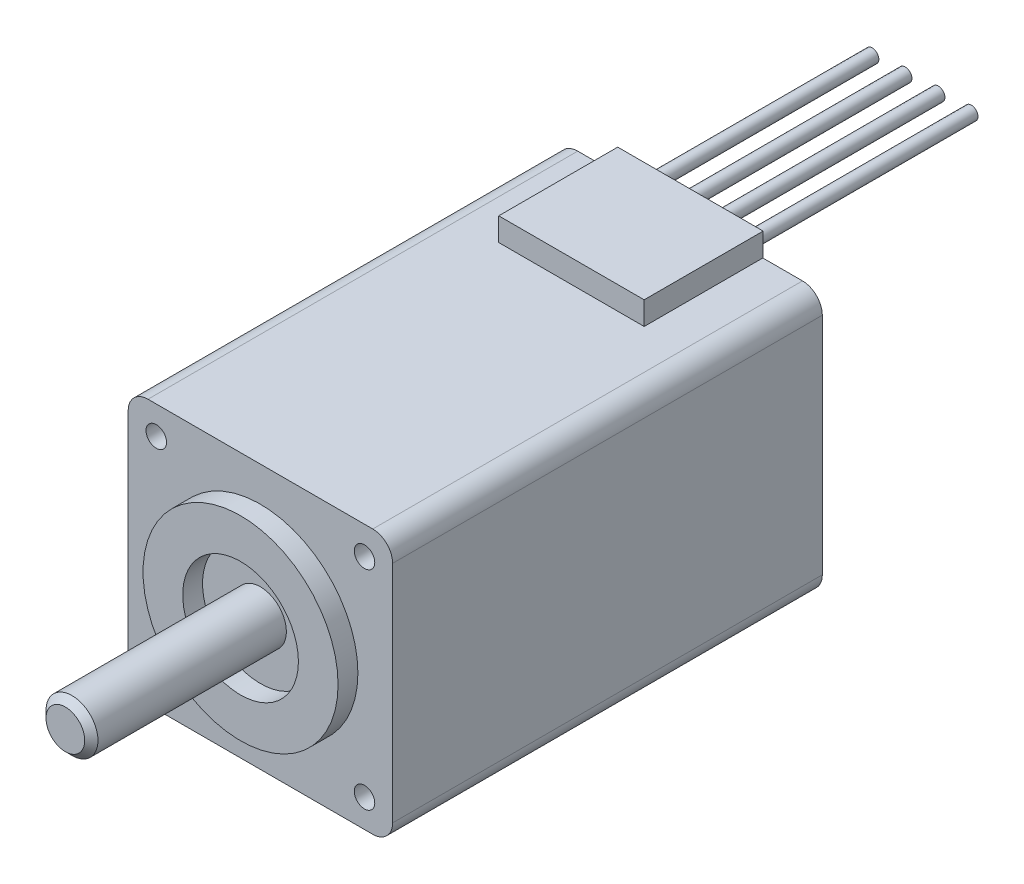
SolidWorks part; units mm, degrees
ref_plane "Front Plane" through (0, 0, 0) normal (0, 0, 1) x (1, 0, 0)
ref_plane "Top Plane" through (0, 0, 0) normal (0, 1, 0) x (1, 0, 0)
ref_plane "Right Plane" through (0, 0, 0) normal (1, 0, 0) x (0, 0, -1)
ref_plane "Plane1" through (0, -10.16, 0) normal (0, -1, 0) x (1, 0, 0)
sketch "Sketch1" plane through (0, -10.16, 0) normal (0, -1, 0) x (1, 0, 0)
  line L0 (10.16, 33.02) -> (-10.16, 33.02)
  line L1 (-10.16, 33.02) -> (-10.16, 0)
  line L2 (-10.16, 0) -> (10.16, 0)
  line L3 (10.16, 0) -> (10.16, 33.02)
extrude "Boss-Extrude1" add sketch "Sketch1" against normal blind 20.32
sketch "Sketch2" plane through (0, 0, 0) normal (0, 0, -1) x (-1, 0, 0)
  line L0 (-5.588, 10.16) -> (5.588, 10.16)
  line L1 (5.588, 10.16) -> (5.588, 8.128)
  line L2 (5.588, 8.128) -> (-5.588, 8.128)
  line L3 (-5.588, 8.128) -> (-5.588, 10.16)
extrude "Boss-Extrude2" add sketch "Sketch2" along normal blind 0.0254
sketch "Sketch3" plane through (0, 10.16, 0) normal (0, 1, 0) x (-1, 0, 0)
  line L0 (-5.588, 9.1186) -> (5.588, 9.1186)
  line L1 (5.588, 9.1186) -> (5.588, -0.0254)
  line L2 (5.588, -0.0254) -> (-5.588, -0.0254)
  line L3 (-5.588, -0.0254) -> (-5.588, 9.1186)
extrude "Boss-Extrude3" add sketch "Sketch3" along normal blind 1.778
sketch "Sketch4" plane through (0, 0, 33.02) normal (0, 0, 1) x (1, 0, 0)
  circle A0 centre (0, 0) radius 7.493
extrude "Boss-Extrude4" add sketch "Sketch4" along normal blind 1.524
hole_wizard "M8 Clearance Hole1" positions "Sketch6" profile "Sketch5" hole size "M8" standard "ANSI Metric"
sketch "Sketch6" plane through (0, 0, 34.544) normal (0, 0, 1) x (1, 0, 0)
  point P0 (0, 0)
sketch "Sketch5" plane through (0, 0, 34.544) normal (1, 0, 0) x (0, -1, 0)
  line L0 (0, 0) -> (0, 1.524)
  line L1 (0, 1.524) -> (4.445, 1.524)
  line L2 (4.445, 1.524) -> (4.445, 0)
  line L5 (4.445, 0) -> (0, 0)
  line L10 (0, 1.524) -> (-4.445, 1.524) construction
  line L11 (0, -6.35) -> (0, 107.95) construction
  dimension "Hole Dia." = 8.89
  dimension "Hole Depth" = 1.524
  dimension "Drill Angle" = 180
ref_plane "Plane2" through (0, 10.033, 0) normal (0, -1, 0) x (1, 0, 0)
sketch "Sketch7" plane through (0, 10.033, 0) normal (0, -1, 0) x (1, 0, 0)
  line L0 (-3.302, -0.0254) -> (-3.81, -0.0254)
  line L1 (-3.81, -0.0254) -> (-3.81, -17.8054)
  line L2 (-3.81, -17.8054) -> (-3.302, -17.8054)
  line L3 (-3.302, -17.8054) -> (-3.302, -0.0254)
  line L4 (-3.81, -0.0254) -> (-3.81, -17.8054) construction
revolve "Revolve1" add sketch "Sketch7" angle 360 about L4
sketch "Sketch8" plane through (0, 10.033, 0) normal (0, -1, 0) x (1, 0, 0)
  line L0 (1.778, -0.0254) -> (1.27, -0.0254)
  line L1 (1.27, -0.0254) -> (1.27, -17.8054)
  line L2 (1.27, -17.8054) -> (1.778, -17.8054)
  line L3 (1.778, -17.8054) -> (1.778, -0.0254)
  line L4 (1.27, -0.0254) -> (1.27, -17.8054) construction
revolve "Revolve2" add sketch "Sketch8" angle 360 about L4
sketch "Sketch9" plane through (0, 10.033, 0) normal (0, -1, 0) x (1, 0, 0)
  line L0 (4.318, -0.0254) -> (3.81, -0.0254)
  line L1 (3.81, -0.0254) -> (3.81, -17.8054)
  line L2 (3.81, -17.8054) -> (4.318, -17.8054)
  line L3 (4.318, -17.8054) -> (4.318, -0.0254)
  line L4 (3.81, -0.0254) -> (3.81, -17.8054) construction
revolve "Revolve3" add sketch "Sketch9" angle 360 about L4
sketch "Sketch10" plane through (0, 10.033, 0) normal (0, -1, 0) x (1, 0, 0)
  line L0 (-0.762, -0.0254) -> (-1.27, -0.0254)
  line L1 (-1.27, -0.0254) -> (-1.27, -17.8054)
  line L2 (-1.27, -17.8054) -> (-0.762, -17.8054)
  line L3 (-0.762, -17.8054) -> (-0.762, -0.0254)
  line L4 (-1.27, -0.0254) -> (-1.27, -17.8054) construction
revolve "Revolve4" add sketch "Sketch10" angle 360 about L4
sketch "Sketch11" plane through (0, 0, 0) normal (0, 1, 0) x (1, 0, 0)
  line L0 (1.9964, -33.02) -> (0, -33.02)
  line L1 (0, -33.02) -> (0, -48.006)
  line L2 (0, -48.006) -> (1.9964, -48.006)
  line L3 (1.9964, -48.006) -> (1.9964, -33.02)
  line L4 (0, -33.02) -> (0, -48.006) construction
revolve "Revolve5" add sketch "Sketch11" angle 360 about L4
hole_wizard "M8 Clearance Hole2" positions "Sketch13" profile "Sketch12" hole size "M8" standard "ANSI Metric"
sketch "Sketch13" plane through (0, 0, 0) normal (0, 0, -1) x (-1, 0, 0)
  point P0 (0, 0)
sketch "Sketch12" plane through (0, 0, 0) normal (1, 0, 0) x (0, 1, 0)
  line L0 (0, 0) -> (0, 0.254)
  line L1 (0, 0.254) -> (4.445, 0.254)
  line L2 (4.445, 0.254) -> (4.445, 0)
  line L5 (4.445, 0) -> (0, 0)
  line L10 (0, 0.254) -> (-4.445, 0.254) construction
  line L11 (0, -6.35) -> (0, 107.95) construction
  dimension "Hole Dia." = 8.89
  dimension "Hole Depth" = 0.254
  dimension "Drill Angle" = 180
hole_wizard "Hole1" positions "Sketch15" profile "Sketch14" legacy
sketch "Sketch15" plane through (0, 0, 33.02) normal (0, 0, 1) x (1, 0, 0)
  point P0 (8.001, -8.001)
  point P1 (-8.001, 8.001)
  point P2 (-8.001, -8.001)
  point P3 (8.001, 8.001)
sketch "Sketch14" plane through (8.001, -8.001, 33.02) normal (1, 0, 0) x (0, -1, 0)
  line L0 (0, 0) -> (0, 3.9783)
  line L1 (0, 3.9783) -> (0.7874, 3.5052)
  line L2 (0.7874, 3.5052) -> (0.7874, 0)
  line L4 (0.7874, 0) -> (0, 0)
  line L6 (0, 3.9783) -> (-0.7874, 3.5052) construction
  line L7 (0, -4.2442) -> (0, 117.3081) construction
  dimension "Diameter" = 1.5748
  dimension "Depth" = 3.5052
  dimension "Drill Angle" = 118
chamfer "Chamfer1" distance 0.508 angle 45 1 edges at (1.9964, 0, 48.006)
fillet "Fillet1" radius 1.524 4 edges at (-10.16, 10.16, 16.51) (-10.16, -10.16, 16.51) (10.16, -10.16, 16.51) (10.16, 10.16, 16.51)
